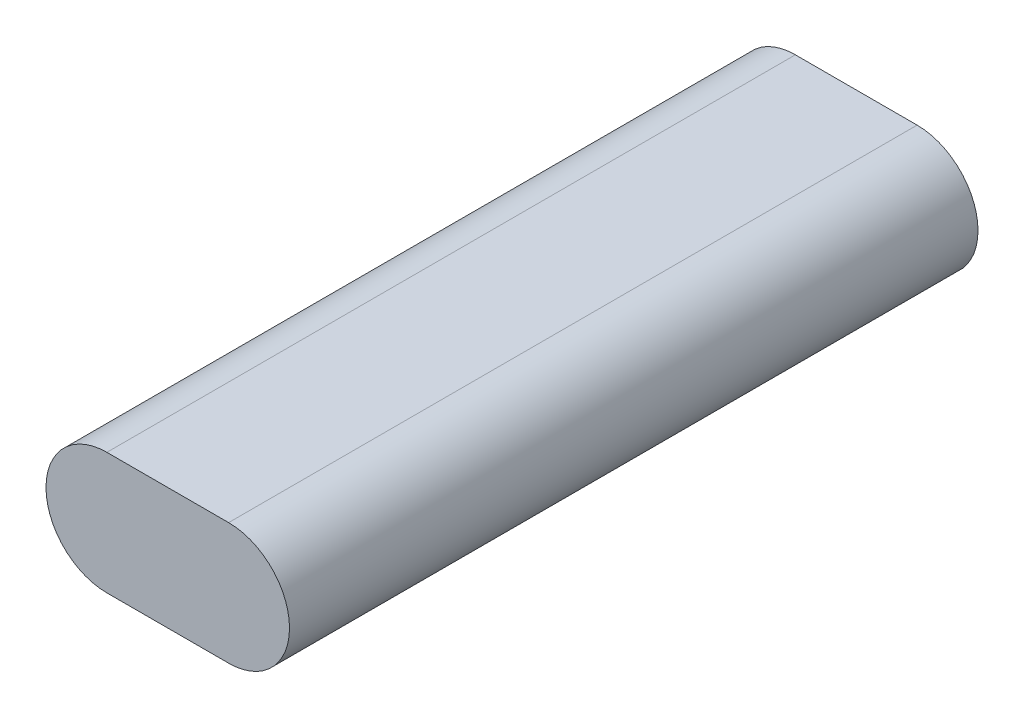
SolidWorks part; units mm, degrees
ref_plane "Front" through (0, 0, 0) normal (0, 0, 1) x (1, 0, 0)
ref_plane "Top" through (0, 0, 0) normal (0, 1, 0) x (1, 0, 0)
ref_plane "Right" through (0, 0, 0) normal (1, 0, 0) x (0, 0, -1)
sketch "Sketch1" plane through (0, 0, 0) normal (0, 0, 1) x (1, 0, 0)
  line L0 (0, 11.5094) -> (23.0188, 11.5094)
  line L1 (0, -11.5094) -> (23.0188, -11.5094)
  arc A0 (0, -11.5094) -> (0, 11.5094) centre (0, 0) cw
  arc A1 (23.0188, 11.5094) -> (23.0188, -11.5094) centre (23.0188, 0) cw
  dimension "D2" = 11.5094
  dimension "D3" = 11.5094
  dimension "D1" = 23.0188
  dimension "D4" = 23.0188
extrude "Extrude1" add sketch "Sketch1" along normal blind 130.175
